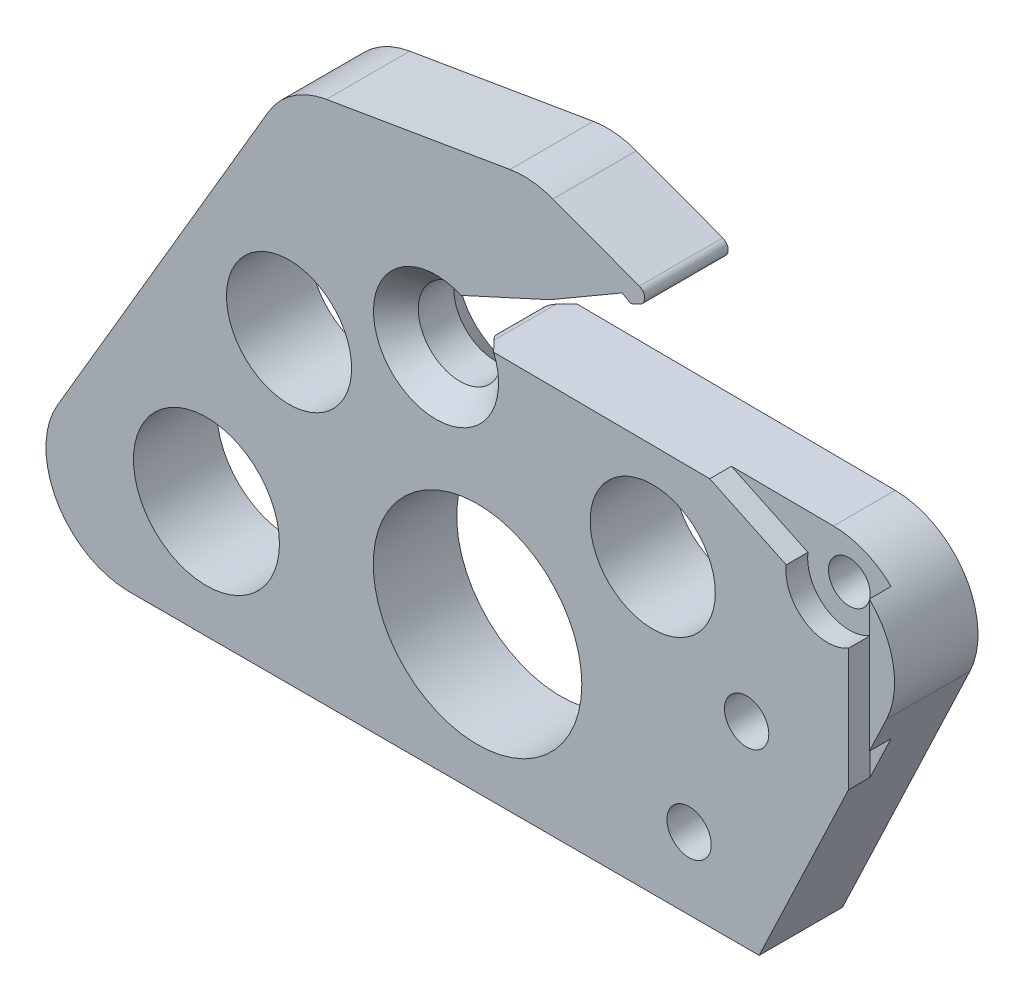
SolidWorks part; units mm, degrees
ref_plane "Front" through (0, 0, 0) normal (0, 0, 1) x (1, 0, 0)
ref_plane "Top" through (0, 0, 0) normal (0, 1, 0) x (1, 0, 0)
ref_plane "Right" through (0, 0, 0) normal (1, 0, 0) x (0, 0, -1)
sketch "Sketch5" plane through (0, 0, 0) normal (0, 0, 1) x (1, 0, 0)
  line L0 (-48.8159, 47.8315) -> (-59.7689, 54.2597)
  line L1 (-53.3406, 65.2127) -> (-16.4332, 128.0985)
  line L2 (-7.5964, 134.1927) -> (23.7097, 139.483)
  line L3 (0, 0) -> (114.1759, 0) construction
  line L4 (14.2304, 113.6112) -> (86.2474, 113.0978)
  line L5 (-53.3406, 65.2127) -> (-59.7689, 54.2597)
  line L6 (86.2474, 113.0978) -> (38.5056, 12.592)
  line L7 (20.6058, 7.0882) -> (-48.8159, 47.8315)
  line L8 (23.7097, 139.483) -> (42.9291, 132.3321)
  line L9 (42.9291, 132.3321) -> (6.4589, 115.6413)
  arc A0 (-16.4332, 128.0985) -> (-7.5964, 134.1927) centre (-5.4803, 121.6703) cw
  arc A1 (14.2304, 113.6112) -> (6.4589, 115.6413) centre (9.1015, 109.8673) cw
  circle A2 centre (-13.2781, 100.6552) radius 9.525
  arc A4 (38.5056, 12.592) -> (20.6058, 7.0882) centre (27.034, 18.0412) cw
  dimension "D1" = 12.7
  dimension "D2" = 6.35
  dimension "D5" = 25
  dimension "D8" = 65
  dimension "D14" = 18.0412
  dimension "D15" = 19.05
  dimension "D4" = 5.08
  dimension "D7" = 85
  dimension "D9" = 90
  dimension "D10" = 130
  dimension "D11" = 150
  dimension "D13" = 27.034
extrude "Base-Extrude" add sketch "Sketch5" along normal mid plane 12.7
fillet "Fillet1" radius 12.7
fillet "Fillet2" radius 1.27
ref_plane "Plane1" through (0, 0, 0) normal (-0.9966, 0.0826, 0) x (0, 0, 1)
sketch "Sketch6" plane through (0, 0, 0) normal (-0.9966, 0.0826, 0) x (0, 0, 1)
  line L0 (-6.35, 110.2436) -> (6.35, 110.2436) construction
  line L1 (6.35, 110.2436) -> (-6.35, 110.2436) construction
  line L2 (-6.35, 126.3045) -> (-6.35, 49.1401) construction
  line L3 (6.35, 126.3045) -> (6.35, 49.1401) construction
  line L4 (0, 110.2436) -> (0, 122.4598) construction
  line L5 (6.35, 119.7686) -> (12.8665, 119.7686)
  line L6 (12.8665, 119.7686) -> (12.8665, 110.2436)
  line L7 (6.35, 119.7686) -> (0, 114.2487)
  line L8 (-12.8665, 119.7686) -> (-12.8665, 110.2436)
  line L9 (-6.35, 119.7686) -> (-12.8665, 119.7686)
  line L10 (-6.35, 119.7686) -> (0, 114.2487)
  line L11 (12.8665, 110.2436) -> (-12.8665, 110.2436)
  dimension "D1" = 19.05
  dimension "D2" = 41
revolve "Cut-Revolve1" cut sketch "Sketch6" angle 360 about L0
sketch "Sketch12" plane through (0, 0, 6.35) normal (0, 0, 1) x (1, 0, 0)
  circle A0 centre (68.7255, 107.0614) radius 0.635
  arc A2 (77.694, 95.0911) -> (66.3129, 113.2399) centre (66.2224, 100.5403) ccw construction
  dimension "D1" = 1.27
  dimension "D2" = 5.715
  dimension "D3" = 59.69
extrude "Cut-Extrude3" cut sketch "Sketch12" against normal through all
sketch "Sketch13" plane through (0, 0, 6.35) normal (0, 0, 1) x (1, 0, 0)
  line L0 (38.7554, 130.422) -> (37.433, 131.1796)
  line L2 (37.433, 131.1796) -> (26.4557, 124.793)
  line L3 (12.9145, 118.5958) -> (40.1411, 131.0562) construction
  line L4 (26.4557, 124.793) -> (38.7554, 130.422)
  dimension "D1" = 1.524
  dimension "D2" = 1.524
  dimension "D3" = 120
  dimension "D4" = 12.7
extrude "Cut-Extrude4" cut sketch "Sketch13" against normal through all
sketch "Sketch14" plane through (0, 0, 6.35) normal (0, 0, 1) x (1, 0, 0)
  circle A0 centre (68.7255, 107.0614) radius 3.175
  circle A3 centre (68.7255, 107.0614) radius 0.635 construction
  dimension "D1" = 6.35
extrude "Cut-Extrude5" cut sketch "Sketch14" against normal through all
sketch "Sketch15" plane through (0, 0, 6.35) normal (0, 0, 1) x (1, 0, 0)
  circle A0 centre (68.7255, 107.0614) radius 6.35
  dimension "D1" = 12.7
extrude "Cut-Extrude6" cut sketch "Sketch15" against normal blind 3.302
sketch "Sketch16" plane through (0, 0, 6.35) normal (0, 0, 1) x (1, 0, 0)
  line L1 (71.9005, 119.7614) -> (75.0755, 119.7614)
  line L2 (71.9005, 119.7614) -> (71.9005, 81.6614)
  line L3 (71.9005, 81.6614) -> (75.0755, 81.6614)
  line L4 (75.0755, 119.7614) -> (75.0755, 81.6614)
  circle A0 centre (68.7255, 107.0614) radius 3.175 construction
  dimension "D1" = 3.175
  dimension "D2" = 25.4
  dimension "D3" = 38.1
extrude "Cut-Extrude7" cut sketch "Sketch16" along normal up to surface (3.302 mm away)
sketch "Sketch20" plane through (0, 0, 6.35) normal (0, 0, 1) x (1, 0, 0)
  line L0 (50.7741, 113.3507) -> (62.4208, 107.8184)
  line L1 (68.7255, 107.0614) -> (76.742, 116.6151) construction
  line L2 (68.7255, 107.0614) -> (51.483, 107.0614) construction
  line L3 (38.5056, 12.592) -> (71.9005, 82.8947) construction
  line L4 (66.3129, 113.2399) -> (17.8709, 113.5853) construction
  line L7 (72.8072, 111.9257) -> (76.742, 116.6151)
  line L8 (76.742, 116.6151) -> (50.7741, 113.3507)
  arc A0 (67.1304, 113.2078) -> (71.9005, 101.5621) centre (68.7255, 107.0614) ccw construction
  arc A1 (72.8072, 111.9257) -> (62.4208, 107.8184) centre (68.7255, 107.0614) ccw
  dimension "D2" = 130
extrude "Cut-Extrude Rev2" cut sketch "Sketch20" along normal up to surface (3.302 mm away)
sketch "Sketch21" plane through (0, 0, 6.35) normal (0, 0, 1) x (1, 0, 0)
  line L0 (-59.7689, 54.2597) -> (91.6709, 54.2597)
  line L2 (91.6709, 54.2597) -> (91.6709, -1.8327)
  line L6 (91.6709, -1.8327) -> (-59.7689, -1.8327)
  line L8 (-59.7689, -1.8327) -> (-59.7689, 54.2597)
extrude "Cut-Extrude11" cut sketch "Sketch21" against normal through all
fillet "Fillet3" radius 12.7
sketch "Sketch24" plane through (0, 0, 6.35) normal (0, 0, 1) x (1, 0, 0)
  circle A0 centre (15.4224, 76.4847) radius 15.875
  circle A1 centre (-25.8526, 72.0397) radius 11.1125
  circle A2 centre (42.0924, 98.7097) radius 9.525
  dimension "D1" = 31.75
  dimension "D2" = 19.05
  dimension "D3" = 22.225
extrude "Cut-Extrude13" cut sketch "Sketch24" against normal through all
sketch "Sketch25" plane through (0, 0, 6.35) normal (0, 0, 1) x (1, 0, 0)
  line L0 (58.2984, 54.2597) -> (-37.5896, 54.2597) construction
  circle A0 centre (56.3934, 84.1555) radius 3.3731
  circle A1 centre (47.6304, 65.1817) radius 3.3731
  dimension "D1" = 6.7462
  dimension "D2" = 6.7462
  dimension "D3" = 10.922
  dimension "D4" = 29.8958
  dimension "D5" = 10.668
  dimension "D6" = 1.905
extrude "Cut-Extrude14" cut sketch "Sketch25" against normal through all
